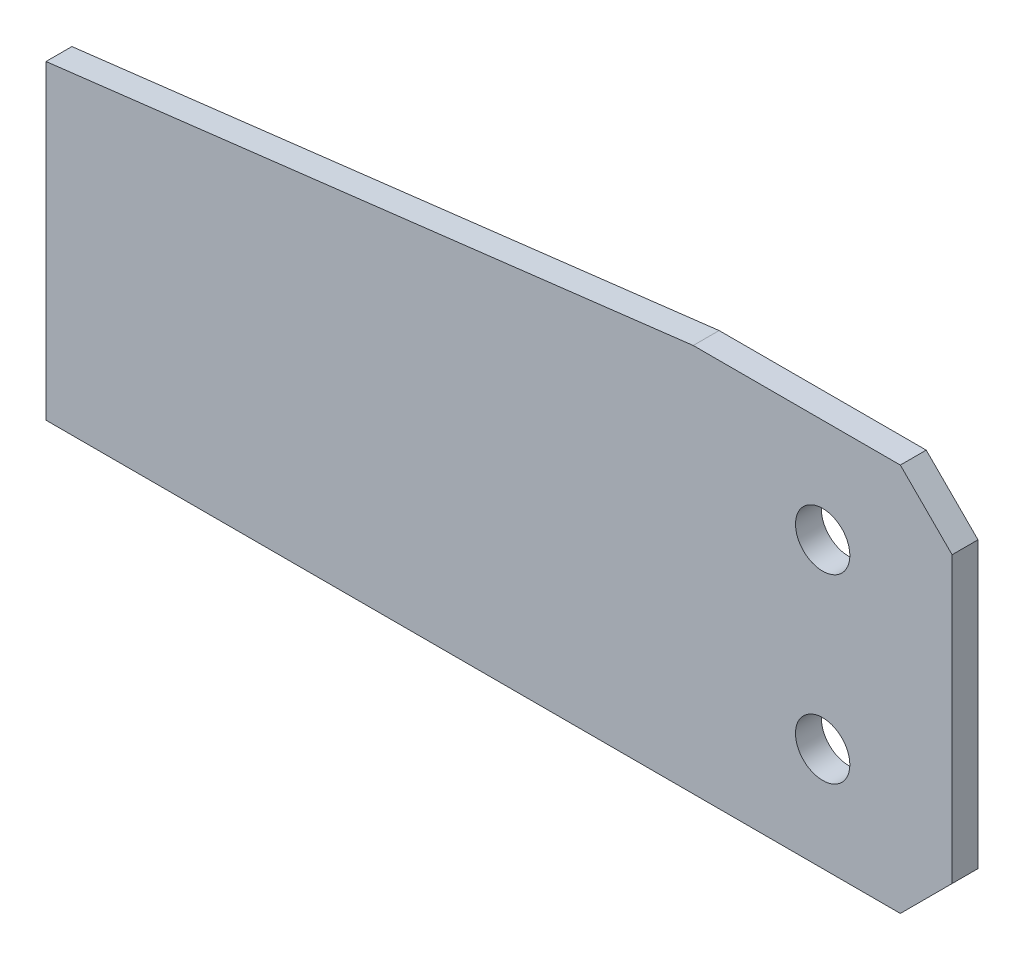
SolidWorks part; units mm, degrees
ref_plane "Face" through (0, 0, 0) normal (0, 0, 1) x (1, 0, 0)
ref_plane "Dessus" through (0, 0, 0) normal (0, 1, 0) x (1, 0, 0)
ref_plane "Droite" through (0, 0, 0) normal (1, 0, 0) x (0, 0, -1)
sketch "Esquisse1" plane through (0, 0, 0) normal (0, 0, 1) x (1, 0, 0)
  line L0 (-100, 0) -> (-350, -30)
  line L1 (-20, 0) -> (-100, 0)
  line L2 (0, -20) -> (0, -130)
  line L3 (-20, -150) -> (-350, -150)
  line L4 (-350, -30) -> (-350, -150)
  line L5 (0, -20) -> (-20, 0)
  line L6 (0, -130) -> (-20, -150)
  circle A0 centre (-50, -40) radius 10.5
  circle A1 centre (-50, -110) radius 10.5
  point P0 (0, 0)
  point P2 (0, -150)
  dimension "D8" = 21
  dimension "D1" = 350
  dimension "D2" = 150
  dimension "D3" = 120
  dimension "D4" = 100
  dimension "D5" = 300
  dimension "D6" = 40
  dimension "D7" = 110
  dimension "D9" = 20
  dimension "D10" = 45
  dimension "D11" = 20
  dimension "D12" = 45
extrude "Base-Extrusion" add sketch "Esquisse1" along normal blind 10
